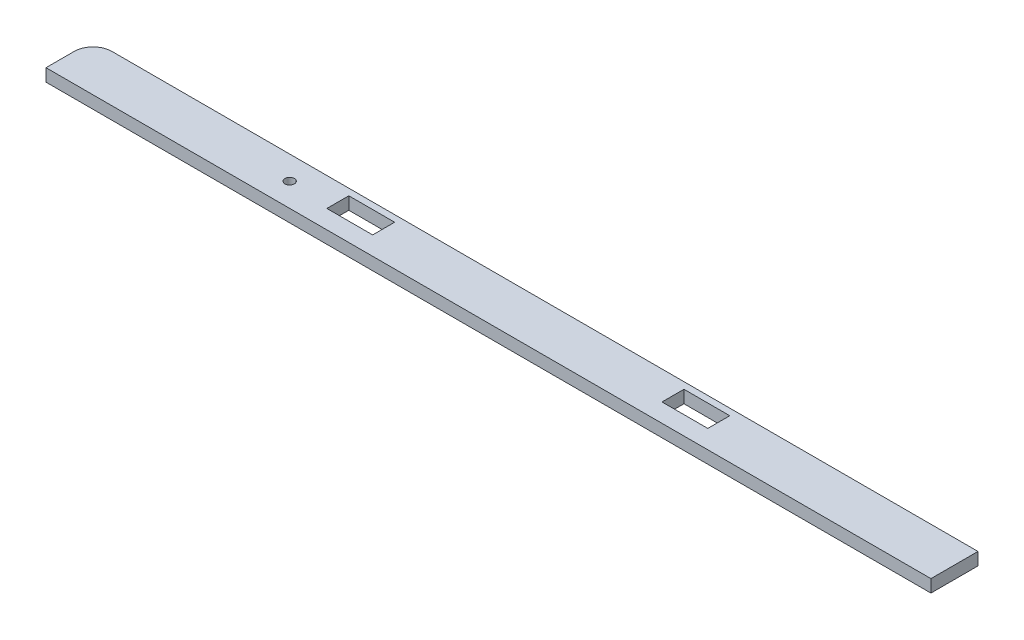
SolidWorks part; units mm, degrees
ref_plane "Front" through (0, 0, 0) normal (0, 0, 1) x (1, 0, 0)
ref_plane "Top" through (0, 0, 0) normal (0, 1, 0) x (1, 0, 0)
ref_plane "Right" through (0, 0, 0) normal (1, 0, 0) x (0, 0, -1)
ref_plane "Plane1" through (0, 3, 0) normal (0, 1, 0) x (1, 0, 0)
sketch "Sketch1" plane through (0, 3, 0) normal (0, 1, 0) x (1, 0, 0)
  line L0 (-141, 106) -> (151, 106)
  line L1 (151, 106) -> (151, 121)
  line L2 (151, 121) -> (-141, 121)
  line L3 (-141, 121) -> (-141, 106)
  circle A0 centre (-70.85, 113.5) radius 1.5
  dimension "D5" = 3
  dimension "D2" = 121
  dimension "D3" = 106
  dimension "D6" = 7.5
extrude "Boss-Extrude1" add sketch "Sketch1" against normal blind 4
sketch "Sketch2" plane through (0, 3, 0) normal (0, 1, 0) x (-1, 0, 0)
  line L0 (-57.4019, -116.9) -> (-53.4, -116.9)
  line L1 (-53.4, -113.9) -> (-57.4019, -113.9)
  line L3 (-49.4, -118.9) -> (-64, -118.9)
  line L4 (-49.4, -118.9) -> (-49.4, -111.9)
  line L5 (-49.4, -111.9) -> (-64, -111.9)
  line L6 (-64, -118.9) -> (-64, -111.9)
  arc A0 (-57.4019, -113.9) -> (-57.4019, -116.9) centre (-60, -115.4) cw
  arc A1 (-53.4, -116.9) -> (-53.4, -113.9) centre (-53.4, -115.4) ccw
  dimension "D3" = 4
  dimension "D4" = 4
  dimension "D1" = 2
  dimension "D2" = 2
extrude "Cut-Extrude1" cut sketch "Sketch2" along direction (0, 1, 0) on the side against the normal through all
sketch "Sketch3" plane through (0, 3, 0) normal (0, 1, 0) x (-1, 0, 0)
  line L0 (49.3981, -116.9) -> (53.4, -116.9)
  line L1 (53.4, -113.9) -> (49.3981, -113.9)
  line L3 (57.4, -118.9) -> (42.8, -118.9)
  line L4 (57.4, -118.9) -> (57.4, -111.9)
  line L5 (57.4, -111.9) -> (42.8, -111.9)
  line L6 (42.8, -118.9) -> (42.8, -111.9)
  arc A0 (49.3981, -113.9) -> (49.3981, -116.9) centre (46.8, -115.4) cw
  arc A1 (53.4, -116.9) -> (53.4, -113.9) centre (53.4, -115.4) ccw
  dimension "D3" = 4
  dimension "D4" = 4
  dimension "D1" = 2
  dimension "D2" = 2
extrude "Cut-Extrude2" cut sketch "Sketch3" against normal through all
fillet "Fillet1" radius 6 1 edges at (-141, 1, -121)
fillet "Fillet2" radius 6 1 edges at (151, 1, -121)
sketch "Sketch4" plane through (0, 0, 0) normal (0, 1, 0) x (1, 0, 0)
  line L0 (145, 121) -> (-135, 121) construction
  line L1 (151, 106) -> (141, 106)
  line L2 (151, 106) -> (151, 121)
  line L3 (151, 121) -> (141, 121)
  line L4 (141, 106) -> (141, 121)
extrude "Cut-Extrude3" cut sketch "Sketch4" against normal blind 10 and the other way blind 10
